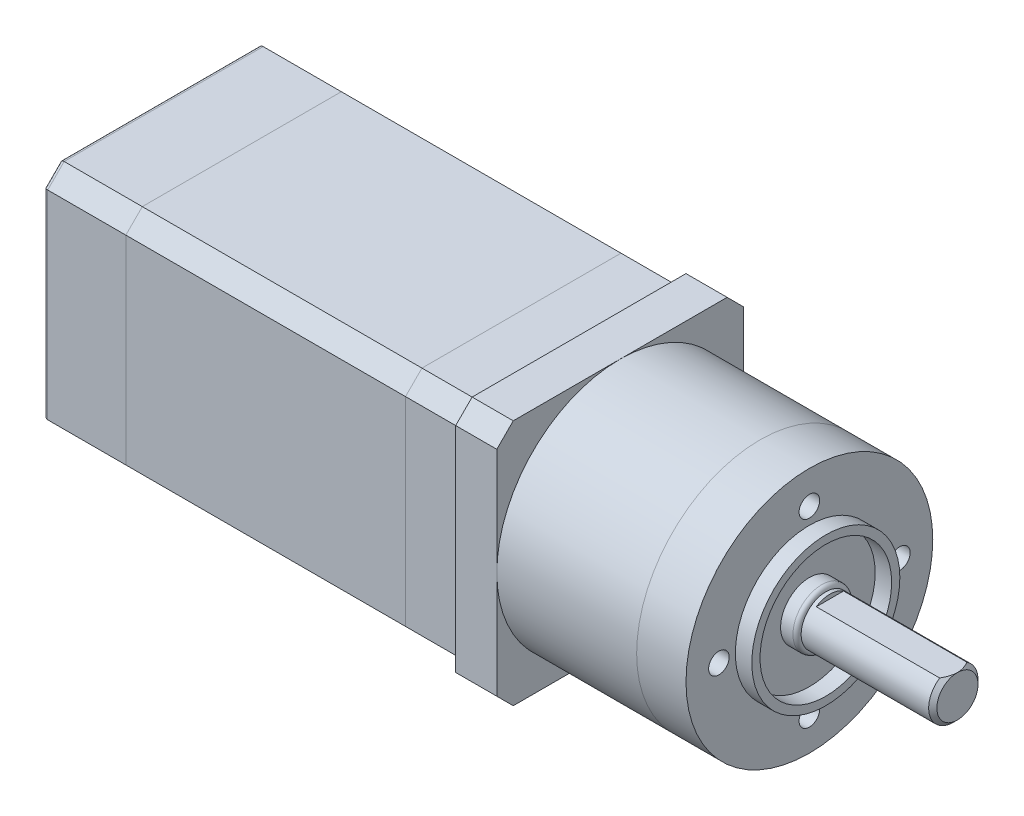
SolidWorks part; units mm, degrees
ref_plane "前视基准面" through (0, 0, 0) normal (0, 0, 1) x (1, 0, 0)
ref_plane "上视基准面" through (0, 0, 0) normal (0, 1, 0) x (1, 0, 0)
ref_plane "右视基准面" through (0, 0, 0) normal (1, 0, 0) x (0, 0, -1)
sketch "草图1" plane through (0, 0, 0) normal (1, 0, 0) x (0, 0, -1)
  circle A0 centre (0, 0) radius 15
extrude "凸台-拉伸1" add sketch "草图1" along normal blind 6
sketch "草图2" plane through (0, 0, 0) normal (-1, 0, 0) x (0, 0, 1)
  circle A0 centre (0, 0) radius 15
extrude "凸台-拉伸2" add sketch "草图2" along normal blind 17 separate body
sketch "草图3" plane through (-17, 0, 0) normal (-1, 0, 0) x (0, 0, 1)
  line L0 (-15, 13) -> (-13, 15)
  line L1 (-13, -15) -> (13, -15)
  line L2 (-15, -13) -> (-15, 13)
  line L3 (-13, 15) -> (13, 15)
  line L4 (15, -13) -> (15, 13)
  line L5 (-15, -15) -> (15, 15) construction
  line L6 (-15, 15) -> (15, -15) construction
  line L7 (13, 15) -> (15, 13)
  line L8 (13, -15) -> (15, -13)
  line L9 (-15, -13) -> (-13, -15)
  point P0 (0, 0)
extrude "凸台-拉伸3" add sketch "草图3" along normal blind 5
sketch "草图4" plane through (-22, 0, 0) normal (-1, 0, 0) x (0, 0, 1)
  line L0 (-14.1, 12.1) -> (-12.1, 14.1)
  line L1 (-12.1, -14.1) -> (12.1, -14.1)
  line L2 (-14.1, -12.1) -> (-14.1, 12.1)
  line L3 (-12.1, 14.1) -> (12.1, 14.1)
  line L4 (14.1, -12.1) -> (14.1, 12.1)
  line L5 (-14.1, -14.1) -> (14.1, 14.1) construction
  line L6 (-14.1, 14.1) -> (14.1, -14.1) construction
  line L7 (12.1, 14.1) -> (14.1, 12.1)
  line L8 (12.1, -14.1) -> (14.1, -12.1)
  line L9 (-14.1, -12.1) -> (-12.1, -14.1)
  point P0 (0, 0)
extrude "凸台-拉伸4" add sketch "草图4" along normal blind 7
sketch "草图5" plane through (-29, 0, 0) normal (-1, 0, 0) x (0, 0, 1)
  line L0 (12.1, 14.1) -> (-12.1, 14.1) construction
  line L1 (-12.1, -14.1) -> (12.1, -14.1)
  line L2 (-14.1, -12.1) -> (-14.1, 12.1)
  line L3 (-12.1, 14.1) -> (12.1, 14.1)
  line L4 (14.1, -12.1) -> (14.1, 12.1)
  line L5 (-14.1, -14.1) -> (14.1, 14.1) construction
  line L6 (-14.1, 14.1) -> (14.1, -14.1) construction
  line L7 (-14.1, 12.1) -> (-12.1, 14.1)
  line L8 (-14.1, -12.1) -> (-12.1, -14.1)
  line L9 (12.1, -14.1) -> (14.1, -12.1)
  line L10 (14.1, 12.1) -> (12.1, 14.1)
  point P0 (0, 0)
extrude "凸台-拉伸5" add sketch "草图5" along normal blind 34 separate body
sketch "草图6" plane through (-63, 0, 0) normal (-1, 0, 0) x (0, 0, 1)
  line L0 (12.1, 14.1) -> (-12.1, 14.1) construction
  line L1 (-12.1, -14.1) -> (12.1, -14.1)
  line L2 (-14.1, -12.1) -> (-14.1, 12.1)
  line L3 (-12.1, 14.1) -> (12.1, 14.1)
  line L4 (14.1, -12.1) -> (14.1, 12.1)
  line L5 (-14.1, -14.1) -> (14.1, 14.1) construction
  line L6 (-14.1, 14.1) -> (14.1, -14.1) construction
  line L7 (-14.1, 12.1) -> (-12.1, 14.1)
  line L8 (-12.1, -14.1) -> (-14.1, -12.1)
  line L9 (12.1, -14.1) -> (14.1, -12.1)
  line L10 (14.1, 12.1) -> (12.1, 14.1)
  point P0 (0, 0)
extrude "凸台-拉伸6" add sketch "草图6" along normal blind 10 separate body
fillet "圆角1" radius 0.5 8 edges at (-73, 14.1, 0) (-73, 13.1, 13.1) (-73, 0, 14.1) (-73, -13.1, 13.1) (-73, -14.1, 0) (-73, -13.1, -13.1) (-73, 0, -14.1) (-73, 13.1, -13.1)
sketch "草图7" plane through (6, 0, 0) normal (1, 0, 0) x (0, 0, -1)
  point P14 (0, 11)
  point P15 (11, 0)
  point P16 (0, -11)
  point P17 (-11, 0)
hole_wizard "M3 螺纹孔1" positions "3D草图1" profile "草图8" tap size "M3" standard "GB"
sketch3d "3D草图1"
  point P0 (6, 11, 0)
  point P3 (6, 0, 11)
  point P6 (6, -11, 0)
  point P9 (6, 0, -11)
sketch "草图8" plane through (6, 11, 0) normal (0, 1, 0) x (0, 0, -1)
  line L0 (0, 0) -> (0, 9.2511)
  line L1 (0, 9.2511) -> (1.25, 8.5)
  line L2 (1.25, 8.5) -> (1.25, 0)
  line L5 (1.25, 0) -> (0, 0)
  line L10 (0, 9.2511) -> (-1.25, 8.5) construction
  line L11 (0, -6.35) -> (0, 107.95) construction
  dimension "螺纹孔钻头直径" = 2.5
  dimension "螺纹孔钻头深度" = 8.5
  dimension "导头角度" = 118
sketch "草图9" plane through (6, 0, 0) normal (1, 0, 0) x (0, 0, -1)
  circle A0 centre (0, 0) radius 9
  circle A1 centre (0, 0) radius 8
extrude "凸台-拉伸7" add sketch "草图9" along normal blind 2 separate body
sketch "草图10" plane through (6, 0, 0) normal (1, 0, 0) x (0, 0, -1)
  circle A0 centre (0, 0) radius 3.5
extrude "凸台-拉伸8" add sketch "草图10" along normal blind 2
fillet "圆角3" radius 0.5 1 edges at (8, 0, -3.5)
sketch "草图12" plane through (8, 0, 0) normal (1, 0, 0) x (0, 0, -1)
  circle A0 centre (0, 0) radius 3
extrude "凸台-拉伸9" add sketch "草图12" along normal blind 16 separate body
sketch "草图13" plane through (24, 0, 0) normal (1, 0, 0) x (0, 0, -1)
  line L2 (1.6583, 2.5) -> (-1.6583, 2.5)
  arc A0 (1.6583, 2.5) -> (-1.6583, 2.5) centre (0, 0) ccw
extrude "切除-拉伸2" cut sketch "草图13" against normal blind 15.5
chamfer "倒角1" distance 0.5 angle 45 1 edges at (24, -3, 0)
